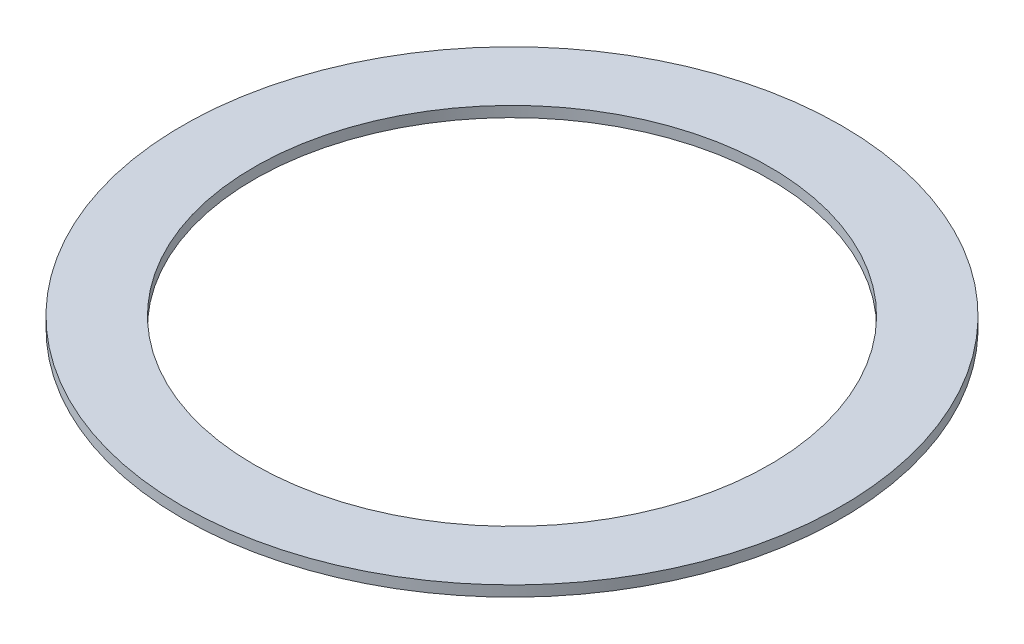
SolidWorks part; units mm, degrees
ref_plane "Front Plane" through (0, 0, 0) normal (0, 0, 1) x (1, 0, 0)
ref_plane "Top Plane" through (0, 0, 0) normal (0, 1, 0) x (1, 0, 0)
ref_plane "Right Plane" through (0, 0, 0) normal (1, 0, 0) x (0, 0, -1)
sketch "Sketch1" plane through (0, 0, 0) normal (0, 1, 0) x (1, 0, 0)
  circle A0 centre (0, 0) radius 24.25
  circle A1 centre (0, 0) radius 31
  dimension "D1" = 48.5
  dimension "D2" = 62
extrude "Boss-Extrude1" add sketch "Sketch1" along normal mid plane 1
